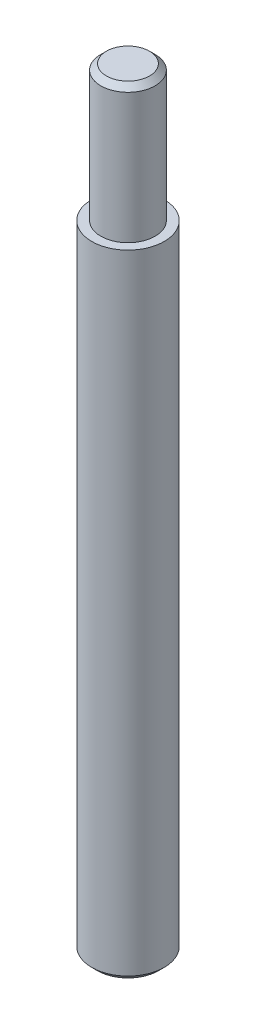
SolidWorks part; units mm, degrees
ref_plane "Front" through (0, 0, 0) normal (0, 0, 1) x (1, 0, 0)
ref_plane "Top" through (0, 0, 0) normal (0, 1, 0) x (1, 0, 0)
ref_plane "Right" through (0, 0, 0) normal (1, 0, 0) x (0, 0, -1)
sketch "Sketch1" plane through (0, 0, 0) normal (0, 1, 0) x (1, 0, 0)
  circle A0 centre (0, 0) radius 4
  dimension "D1" = 8
extrude "Extrude1" add sketch "Sketch1" along normal blind 85
chamfer "Chamfer1" distance 0.625 angle 45 2 edges at (0, 0, 4) (0, 85, 4)
sketch "Sketch2" plane through (0, 85, 0) normal (0, 1, 0) x (1, 0, 0)
  circle A0 centre (0, 0) radius 6.9221
  circle A1 centre (0, 0) radius 3
  dimension "D1" = 6
extrude "Extrude2" cut sketch "Sketch2" against normal blind 15
chamfer "Chamfer2" distance 0.625 angle 45 1 edges at (0, 85, 3)
